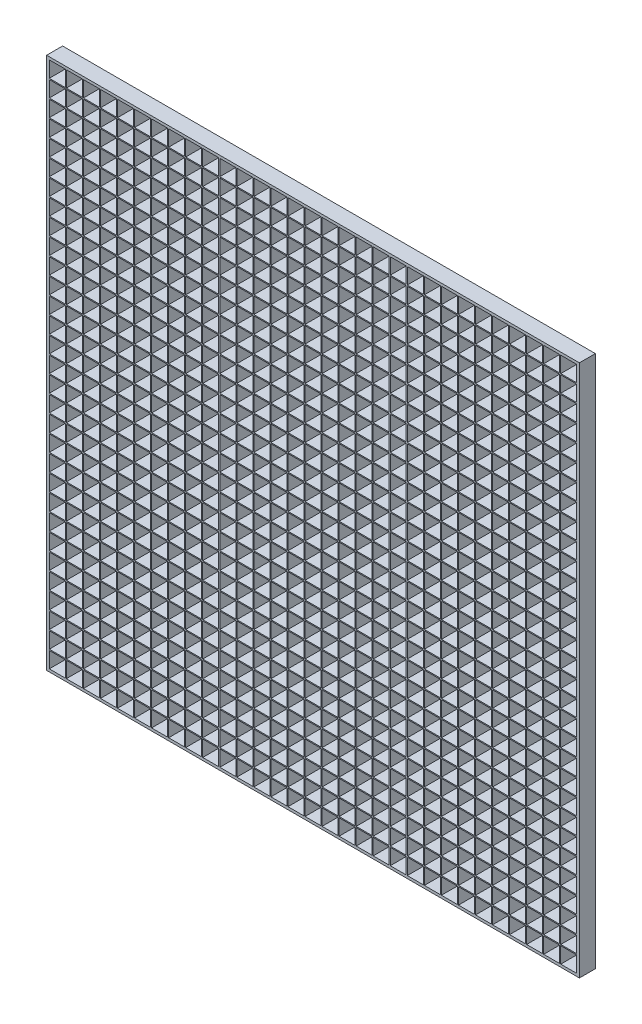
SolidWorks part; units mm, degrees
ref_plane "Ebene vorne" through (0, 0, 0) normal (0, 0, 1) x (1, 0, 0)
ref_plane "Ebene oben" through (0, 0, 0) normal (0, 1, 0) x (1, 0, 0)
ref_plane "Ebene rechts" through (0, 0, 0) normal (1, 0, 0) x (0, 0, -1)
sketch "Skizze1" plane through (0, 0, 0) normal (0, 0, 1) x (1, 0, 0)
  line L0 (5, 5) -> (5, 995)
  line L1 (0, 0) -> (1000, 0)
  line L2 (0, 0) -> (0, 1000)
  line L3 (0, 1000) -> (1000, 1000)
  line L4 (1000, 0) -> (1000, 1000)
  line L5 (5, 995) -> (995, 995)
  line L6 (995, 5) -> (995, 995)
  line L7 (5, 5) -> (995, 5)
  dimension "D1" = 1000
  dimension "D2" = 1000
  dimension "D3" = 5
extrude "Aufsatz-Linear austragen1" add sketch "Skizze1" along normal blind 30
sketch "Skizze3" plane through (0, 0, 0) normal (0, 0, 1) x (1, 0, 0)
  line L0 (5, 995) -> (5, 5) construction
  line L4 (5, 35) -> (995, 35)
  line L6 (5, 35) -> (5, 37)
  line L7 (5, 37) -> (995, 37)
  line L8 (995, 35) -> (995, 37)
  line L9 (995, 5) -> (995, 995) construction
  line L10 (5, 5) -> (995, 5) construction
  line L11 (5, 67) -> (995, 67)
  line L12 (995, 67) -> (995, 69)
  line L13 (5, 69) -> (995, 69)
  line L14 (5, 67) -> (5, 69)
  line L15 (5, 99) -> (995, 99)
  line L16 (995, 99) -> (995, 101)
  line L17 (5, 101) -> (995, 101)
  line L18 (5, 99) -> (5, 101)
  line L19 (5, 131) -> (995, 131)
  line L20 (995, 131) -> (995, 133)
  line L21 (5, 133) -> (995, 133)
  line L22 (5, 131) -> (5, 133)
  line L23 (5, 163) -> (995, 163)
  line L24 (995, 163) -> (995, 165)
  line L25 (5, 165) -> (995, 165)
  line L26 (5, 163) -> (5, 165)
  line L27 (5, 195) -> (995, 195)
  line L28 (995, 195) -> (995, 197)
  line L29 (5, 197) -> (995, 197)
  line L30 (5, 195) -> (5, 197)
  line L31 (5, 227) -> (995, 227)
  line L32 (995, 227) -> (995, 229)
  line L33 (5, 229) -> (995, 229)
  line L34 (5, 227) -> (5, 229)
  line L35 (5, 259) -> (995, 259)
  line L36 (995, 259) -> (995, 261)
  line L37 (5, 261) -> (995, 261)
  line L38 (5, 259) -> (5, 261)
  line L39 (5, 291) -> (995, 291)
  line L40 (995, 291) -> (995, 293)
  line L41 (5, 293) -> (995, 293)
  line L42 (5, 291) -> (5, 293)
  line L43 (5, 323) -> (995, 323)
  line L44 (995, 323) -> (995, 325)
  line L45 (5, 325) -> (995, 325)
  line L46 (5, 323) -> (5, 325)
  line L47 (5, 355) -> (995, 355)
  line L48 (995, 355) -> (995, 357)
  line L49 (5, 357) -> (995, 357)
  line L50 (5, 355) -> (5, 357)
  line L51 (5, 387) -> (995, 387)
  line L52 (995, 387) -> (995, 389)
  line L53 (5, 389) -> (995, 389)
  line L54 (5, 387) -> (5, 389)
  line L55 (5, 419) -> (995, 419)
  line L56 (995, 419) -> (995, 421)
  line L57 (5, 421) -> (995, 421)
  line L58 (5, 419) -> (5, 421)
  line L59 (5, 451) -> (995, 451)
  line L60 (995, 451) -> (995, 453)
  line L61 (5, 453) -> (995, 453)
  line L62 (5, 451) -> (5, 453)
  line L63 (5, 483) -> (995, 483)
  line L64 (995, 483) -> (995, 485)
  line L65 (5, 485) -> (995, 485)
  line L66 (5, 483) -> (5, 485)
  line L67 (5, 515) -> (995, 515)
  line L68 (995, 515) -> (995, 517)
  line L69 (5, 517) -> (995, 517)
  line L70 (5, 515) -> (5, 517)
  line L71 (5, 547) -> (995, 547)
  line L72 (995, 547) -> (995, 549)
  line L73 (5, 549) -> (995, 549)
  line L74 (5, 547) -> (5, 549)
  line L75 (5, 579) -> (995, 579)
  line L76 (995, 579) -> (995, 581)
  line L77 (5, 581) -> (995, 581)
  line L78 (5, 579) -> (5, 581)
  line L79 (5, 611) -> (995, 611)
  line L80 (995, 611) -> (995, 613)
  line L81 (5, 613) -> (995, 613)
  line L82 (5, 611) -> (5, 613)
  line L83 (5, 643) -> (995, 643)
  line L84 (995, 643) -> (995, 645)
  line L85 (5, 645) -> (995, 645)
  line L86 (5, 643) -> (5, 645)
  line L87 (5, 675) -> (995, 675)
  line L88 (995, 675) -> (995, 677)
  line L89 (5, 677) -> (995, 677)
  line L90 (5, 675) -> (5, 677)
  line L91 (5, 707) -> (995, 707)
  line L92 (995, 707) -> (995, 709)
  line L93 (5, 709) -> (995, 709)
  line L94 (5, 707) -> (5, 709)
  line L95 (5, 739) -> (995, 739)
  line L96 (995, 739) -> (995, 741)
  line L97 (5, 741) -> (995, 741)
  line L98 (5, 739) -> (5, 741)
  line L99 (5, 771) -> (995, 771)
  line L100 (995, 771) -> (995, 773)
  line L101 (5, 773) -> (995, 773)
  line L102 (5, 771) -> (5, 773)
  line L103 (5, 803) -> (995, 803)
  line L104 (995, 803) -> (995, 805)
  line L105 (5, 805) -> (995, 805)
  line L106 (5, 803) -> (5, 805)
  line L107 (5, 835) -> (995, 835)
  line L108 (995, 835) -> (995, 837)
  line L109 (5, 837) -> (995, 837)
  line L110 (5, 835) -> (5, 837)
  line L111 (5, 867) -> (995, 867)
  line L112 (995, 867) -> (995, 869)
  line L113 (5, 869) -> (995, 869)
  line L114 (5, 867) -> (5, 869)
  line L115 (5, 899) -> (995, 899)
  line L116 (995, 899) -> (995, 901)
  line L117 (5, 901) -> (995, 901)
  line L118 (5, 899) -> (5, 901)
  line L119 (5, 931) -> (995, 931)
  line L120 (995, 931) -> (995, 933)
  line L121 (5, 933) -> (995, 933)
  line L122 (5, 931) -> (5, 933)
  line L123 (5, 963) -> (995, 963)
  line L124 (995, 963) -> (995, 965)
  line L125 (5, 965) -> (995, 965)
  line L126 (5, 963) -> (5, 965)
  line L127 (5, 35) -> (5, 67) construction
  dimension "D1" = 2
  dimension "D3" = 30
  dimension "D4" = 32
  dimension "D2" = 30
extrude "Aufsatz-Linear austragen2" add sketch "Skizze3" along normal up to surface (30 mm away)
sketch "Skizze5" plane through (0, 0, 0) normal (0, 0, 1) x (1, 0, 0)
  line L0 (995, 995) -> (5, 995) construction
  line L1 (35, 995) -> (37, 995)
  line L2 (35, 995) -> (35, 5)
  line L3 (35, 5) -> (37, 5)
  line L4 (37, 995) -> (37, 5)
  line L5 (5, 5) -> (995, 5) construction
  line L6 (5, 35) -> (5, 5) construction
  line L7 (67, 995) -> (67, 5)
  line L8 (67, 5) -> (69, 5)
  line L9 (69, 995) -> (69, 5)
  line L10 (67, 995) -> (69, 995)
  line L11 (99, 995) -> (99, 5)
  line L12 (99, 5) -> (101, 5)
  line L13 (101, 995) -> (101, 5)
  line L14 (99, 995) -> (101, 995)
  line L15 (131, 995) -> (131, 5)
  line L16 (131, 5) -> (133, 5)
  line L17 (133, 995) -> (133, 5)
  line L18 (131, 995) -> (133, 995)
  line L19 (163, 995) -> (163, 5)
  line L20 (163, 5) -> (165, 5)
  line L21 (165, 995) -> (165, 5)
  line L22 (163, 995) -> (165, 995)
  line L23 (195, 995) -> (195, 5)
  line L24 (195, 5) -> (197, 5)
  line L25 (197, 995) -> (197, 5)
  line L26 (195, 995) -> (197, 995)
  line L27 (227, 995) -> (227, 5)
  line L28 (227, 5) -> (229, 5)
  line L29 (229, 995) -> (229, 5)
  line L30 (227, 995) -> (229, 995)
  line L31 (259, 995) -> (259, 5)
  line L32 (259, 5) -> (261, 5)
  line L33 (261, 995) -> (261, 5)
  line L34 (259, 995) -> (261, 995)
  line L35 (291, 995) -> (291, 5)
  line L36 (291, 5) -> (293, 5)
  line L37 (293, 995) -> (293, 5)
  line L38 (291, 995) -> (293, 995)
  line L39 (323, 995) -> (323, 5)
  line L40 (323, 5) -> (325, 5)
  line L41 (325, 995) -> (325, 5)
  line L42 (323, 995) -> (325, 995)
  line L43 (355, 995) -> (355, 5)
  line L44 (355, 5) -> (357, 5)
  line L45 (357, 995) -> (357, 5)
  line L46 (355, 995) -> (357, 995)
  line L47 (387, 995) -> (387, 5)
  line L48 (387, 5) -> (389, 5)
  line L49 (389, 995) -> (389, 5)
  line L50 (387, 995) -> (389, 995)
  line L51 (419, 995) -> (419, 5)
  line L52 (419, 5) -> (421, 5)
  line L53 (421, 995) -> (421, 5)
  line L54 (419, 995) -> (421, 995)
  line L55 (451, 995) -> (451, 5)
  line L56 (451, 5) -> (453, 5)
  line L57 (453, 995) -> (453, 5)
  line L58 (451, 995) -> (453, 995)
  line L59 (483, 995) -> (483, 5)
  line L60 (483, 5) -> (485, 5)
  line L61 (485, 995) -> (485, 5)
  line L62 (483, 995) -> (485, 995)
  line L63 (515, 995) -> (515, 5)
  line L64 (515, 5) -> (517, 5)
  line L65 (517, 995) -> (517, 5)
  line L66 (515, 995) -> (517, 995)
  line L67 (547, 995) -> (547, 5)
  line L68 (547, 5) -> (549, 5)
  line L69 (549, 995) -> (549, 5)
  line L70 (547, 995) -> (549, 995)
  line L71 (579, 995) -> (579, 5)
  line L72 (579, 5) -> (581, 5)
  line L73 (581, 995) -> (581, 5)
  line L74 (579, 995) -> (581, 995)
  line L75 (611, 995) -> (611, 5)
  line L76 (611, 5) -> (613, 5)
  line L77 (613, 995) -> (613, 5)
  line L78 (611, 995) -> (613, 995)
  line L79 (643, 995) -> (643, 5)
  line L80 (643, 5) -> (645, 5)
  line L81 (645, 995) -> (645, 5)
  line L82 (643, 995) -> (645, 995)
  line L83 (675, 995) -> (675, 5)
  line L84 (675, 5) -> (677, 5)
  line L85 (677, 995) -> (677, 5)
  line L86 (675, 995) -> (677, 995)
  line L87 (707, 995) -> (707, 5)
  line L88 (707, 5) -> (709, 5)
  line L89 (709, 995) -> (709, 5)
  line L90 (707, 995) -> (709, 995)
  line L91 (739, 995) -> (739, 5)
  line L92 (739, 5) -> (741, 5)
  line L93 (741, 995) -> (741, 5)
  line L94 (739, 995) -> (741, 995)
  line L95 (771, 995) -> (771, 5)
  line L96 (771, 5) -> (773, 5)
  line L97 (773, 995) -> (773, 5)
  line L98 (771, 995) -> (773, 995)
  line L99 (803, 995) -> (803, 5)
  line L100 (803, 5) -> (805, 5)
  line L101 (805, 995) -> (805, 5)
  line L102 (803, 995) -> (805, 995)
  line L103 (835, 995) -> (835, 5)
  line L104 (835, 5) -> (837, 5)
  line L105 (837, 995) -> (837, 5)
  line L106 (835, 995) -> (837, 995)
  line L107 (867, 995) -> (867, 5)
  line L108 (867, 5) -> (869, 5)
  line L109 (869, 995) -> (869, 5)
  line L110 (867, 995) -> (869, 995)
  line L111 (899, 995) -> (899, 5)
  line L112 (899, 5) -> (901, 5)
  line L113 (901, 995) -> (901, 5)
  line L114 (899, 995) -> (901, 995)
  line L115 (931, 995) -> (931, 5)
  line L116 (931, 5) -> (933, 5)
  line L117 (933, 995) -> (933, 5)
  line L118 (931, 995) -> (933, 995)
  line L119 (963, 995) -> (963, 5)
  line L120 (963, 5) -> (965, 5)
  line L121 (965, 995) -> (965, 5)
  line L122 (963, 995) -> (965, 995)
  line L123 (35, 995) -> (67, 995) construction
  dimension "D1" = 2
  dimension "D2" = 30
  dimension "D4" = 32
  dimension "D3" = 30
extrude "Aufsatz-Linear austragen3" add sketch "Skizze5" along normal up to surface (30 mm away)
